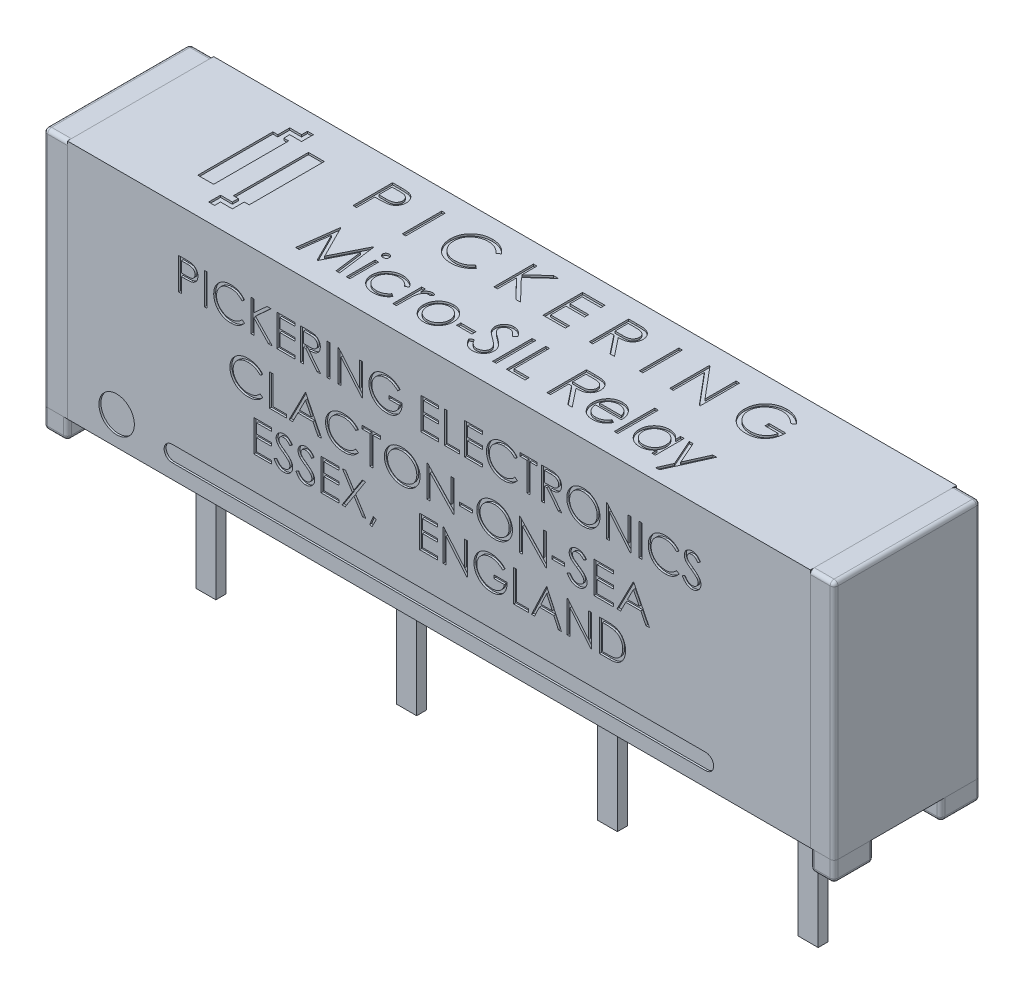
SolidWorks part; units mm, degrees
ref_plane "Front Plane" through (0, 0, 0) normal (0, 0, 1) x (1, 0, 0)
ref_plane "Top Plane" through (0, 0, 0) normal (0, 1, 0) x (1, 0, 0)
ref_plane "Right Plane" through (0, 0, 0) normal (1, 0, 0) x (0, 0, -1)
sketch "Sketch1" plane through (0, 0, 0) normal (0, 1, 0) x (1, 0, 0)
  line L1 (9.4, -1.85) -> (-9.4, -1.85)
  line L2 (9.4, -1.85) -> (9.4, 1.85)
  line L3 (9.4, 1.85) -> (-9.4, 1.85)
  line L4 (-9.4, -1.85) -> (-9.4, 1.85)
  line L5 (9.4, -1.85) -> (-9.4, 1.85) construction
  line L6 (9.4, 1.85) -> (-9.4, -1.85) construction
  point P0 (0, 0)
  dimension "D1" = 3.7
  dimension "D2" = 18.8
extrude "Main Body" add sketch "Sketch1" along normal blind 6.092
sketch "Sketch2" plane through (-9.4, 0, 0) normal (-1, 0, 0) x (0, 0, 1)
  line L1 (-1.85, 6.092) -> (1.85, 6.092)
  line L2 (-1.85, 6.092) -> (-1.85, 0)
  line L3 (-1.85, 0) -> (1.85, 0)
  line L4 (1.85, 6.092) -> (1.85, 0)
extrude "Left Side" add sketch "Sketch2" along normal blind 0.6 separate body
sketch "Sketch3" plane through (9.4, 0, 0) normal (1, 0, 0) x (0, 0, -1)
  line L1 (-1.85, 6.092) -> (1.85, 6.092)
  line L2 (-1.85, 6.092) -> (-1.85, 0)
  line L3 (-1.85, 0) -> (1.85, 0)
  line L4 (1.85, 6.092) -> (1.85, 0)
extrude "Right Side" add sketch "Sketch3" along normal blind 0.6 separate body
sketch "Sketch4" plane through (0, 0, 0) normal (0, -1, 0) x (1, 0, 0)
  line L0 (-9.4, -1.85) -> (-9.4, 1.85) construction
  line L1 (-10, 1.85) -> (-9.4, 1.85)
  line L2 (-10, 1.85) -> (-10, 0.85)
  line L3 (-10, 0.85) -> (-9.4, 0.85)
  line L4 (-9.4, 1.85) -> (-9.4, 0.85)
  line L5 (-9.4, -1.85) -> (-9.4, 1.85) construction
  line L6 (-10, -1.85) -> (-9.4, -1.85)
  line L7 (-10, -1.85) -> (-10, -0.85)
  line L8 (-10, -0.85) -> (-9.4, -0.85)
  line L9 (-9.4, -1.85) -> (-9.4, -0.85)
  line L10 (9.4, 1.85) -> (9.4, -1.85) construction
  line L11 (10, 1.85) -> (9.4, 1.85)
  line L12 (10, 1.85) -> (10, 0.85)
  line L13 (10, 0.85) -> (9.4, 0.85)
  line L14 (9.4, 1.85) -> (9.4, 0.85)
  line L15 (9.4, 1.85) -> (9.4, -1.85) construction
  line L16 (10, -1.85) -> (9.4, -1.85)
  line L17 (10, -1.85) -> (10, -0.85)
  line L18 (10, -0.85) -> (9.4, -0.85)
  line L19 (9.4, -1.85) -> (9.4, -0.85)
  dimension "D1" = 1
  dimension "D2" = 1
  dimension "D3" = 1
  dimension "D4" = 1
extrude "Feet" add sketch "Sketch4" along normal blind 0.508 separate body
sketch "Sketch5" plane through (0, 0, 0) normal (0, -1, 0) x (1, 0, 0)
  line L0 (10, 1.85) -> (10, -1.85) construction
  line L1 (-7.874, -0.127) -> (-7.366, -0.127)
  line L2 (-7.874, -0.127) -> (-7.874, 0.127)
  line L3 (-7.874, 0.127) -> (-7.366, 0.127)
  line L4 (-7.366, -0.127) -> (-7.366, 0.127)
  line L5 (-7.874, -0.127) -> (-7.366, 0.127) construction
  line L6 (-7.874, 0.127) -> (-7.366, -0.127) construction
  line L7 (-2.286, -0.127) -> (-2.794, -0.127)
  line L8 (-2.286, -0.127) -> (-2.286, 0.127)
  line L9 (-2.286, 0.127) -> (-2.794, 0.127)
  line L10 (-2.794, -0.127) -> (-2.794, 0.127)
  line L11 (-2.286, -0.127) -> (-2.794, 0.127) construction
  line L12 (-2.286, 0.127) -> (-2.794, -0.127) construction
  line L13 (2.794, -0.127) -> (2.286, -0.127)
  line L14 (2.794, -0.127) -> (2.794, 0.127)
  line L15 (2.794, 0.127) -> (2.286, 0.127)
  line L16 (2.286, -0.127) -> (2.286, 0.127)
  line L17 (2.794, -0.127) -> (2.286, 0.127) construction
  line L18 (2.794, 0.127) -> (2.286, -0.127) construction
  line L19 (7.366, -0.127) -> (7.874, -0.127)
  line L20 (7.366, -0.127) -> (7.366, 0.127)
  line L21 (7.366, 0.127) -> (7.874, 0.127)
  line L22 (7.874, -0.127) -> (7.874, 0.127)
  line L23 (7.366, -0.127) -> (7.874, 0.127) construction
  line L24 (7.366, 0.127) -> (7.874, -0.127) construction
  point P0 (-7.62, 0)
  point P5 (-2.54, 0)
  point P10 (2.54, 0)
  point P15 (7.62, 0)
  dimension "D1" = 0.508
  dimension "D2" = 0.254
  dimension "D3" = 0.508
  dimension "D4" = 0.254
  dimension "D5" = 0.508
  dimension "D6" = 0.254
  dimension "D7" = 0.508
  dimension "D8" = 0.254
  dimension "D9" = 5.08
  dimension "D10" = 5.08
  dimension "D11" = 5.08
  dimension "D12" = 2.38
extrude "Pins" add sketch "Sketch5" along normal blind 3.808
sketch "Sketch6"
  dimension "D1" = 10.5
  dimension "D2" = 10.5
  dimension "D3" = 4
  dimension "D4" = 0.45
  dimension "D5" = 3
  dimension "D6" = 1.5
sketch_block_instance "Logo-1"
sketch_block "Logo" parameters "D1"=0.4, "D2"=0.4, "D3"=1.9, "D4"=1.9, "D5"=1.3, "D6"=0.3, "D7"=0.15, "D8"=0.15, "D9"=0.15, "D10"=0.15, "D11"=0.3, "D12"=0.125, "D13"=0.15, "D14"=0.125, "D15"=0.3, "D16"=0.15, "D17"=0.3, "D18"=0.15, "D19"=0.15
extrude "Top side" cut sketch "Sketch6" against normal blind 0.05
sketch "Sketch7"
  dimension "D10" = 0.8963
  dimension "D1" = 13.5
  dimension "D2" = 11
  dimension "D3" = 9.6
  dimension "D4" = 3.25
  dimension "D5" = 4.5
  dimension "D6" = 5.2
  dimension "D7" = 1.9
  dimension "D8" = 1.4
  dimension "D9" = 1.2
extrude "Front Lettering" cut sketch "Sketch7" against normal blind 0.05
sketch "Sketch8"
  dimension "D1" = 11.65
  dimension "D2" = 4.175
  dimension "D3" = 3.5
extrude "Part number" add sketch "Sketch8" along normal blind 0.0001
sketch "Sketch9" plane through (0, 0, -1.85) normal (0, 0, -1) x (-1, 0, 0)
  line L0 (-5.5254, 0.8409) -> (5.9665, 0.8409) construction
  line L1 (-5.5254, 0.9836) -> (5.9665, 0.9836)
  line L2 (-5.5254, 0.6982) -> (5.9665, 0.6982)
  arc A0 (-5.5254, 0.9836) -> (-5.5254, 0.6982) centre (-5.5254, 0.8409) ccw
  arc A1 (5.9665, 0.6982) -> (5.9665, 0.9836) centre (5.9665, 0.8409) ccw
  point P2 (0.2205, 0.8409)
extrude "Extrude9" cut sketch "Sketch9" against normal blind 0.0001
fillet "Fillet1" radius 0.1 5 edges at (10, 3.046, -1.85) (9.7, 6.092, -1.85) (10, 6.092, 0) (9.7, 6.092, 1.85) (10, 3.046, 1.85)
fillet "Fillet2" radius 0.1 5 edges at (-9.7, 6.092, 1.85) (-10, 3.046, 1.85) (-10, 3.046, -1.85) (-9.7, 6.092, -1.85) (-10, 6.092, 0)
fillet "Fillet3" radius 0.1 8 edges at (-9.7, -0.508, 1.85) (-9.4, -0.508, 1.35) (-9.7, -0.508, 0.85) (-10, -0.508, 1.35) (-9.4, -0.254, 1.85) (-9.4, -0.254, 0.85) (-10, -0.254, 0.85) (-10, -0.254, 1.85)
fillet "Fillet4" radius 0.1 8 edges at (-9.7, -0.508, -0.85) (-9.4, -0.508, -1.35) (-9.7, -0.508, -1.85) (-10, -0.508, -1.35) (-10, -0.254, -1.85) (-9.4, -0.254, -1.85) (-9.4, -0.254, -0.85) (-10, -0.254, -0.85)
fillet "Fillet5" radius 0.1 8 edges at (9.7, -0.508, -1.85) (9.4, -0.508, -1.35) (9.7, -0.508, -0.85) (10, -0.508, -1.35) (9.4, -0.254, -0.85) (10, -0.254, -0.85) (9.4, -0.254, -1.85) (10, -0.254, -1.85)
fillet "Fillet6" radius 0.1 8 edges at (9.7, -0.508, 0.85) (9.4, -0.508, 1.35) (9.7, -0.508, 1.85) (10, -0.508, 1.35) (9.4, -0.254, 0.85) (10, -0.254, 0.85) (10, -0.254, 1.85) (9.4, -0.254, 1.85)
